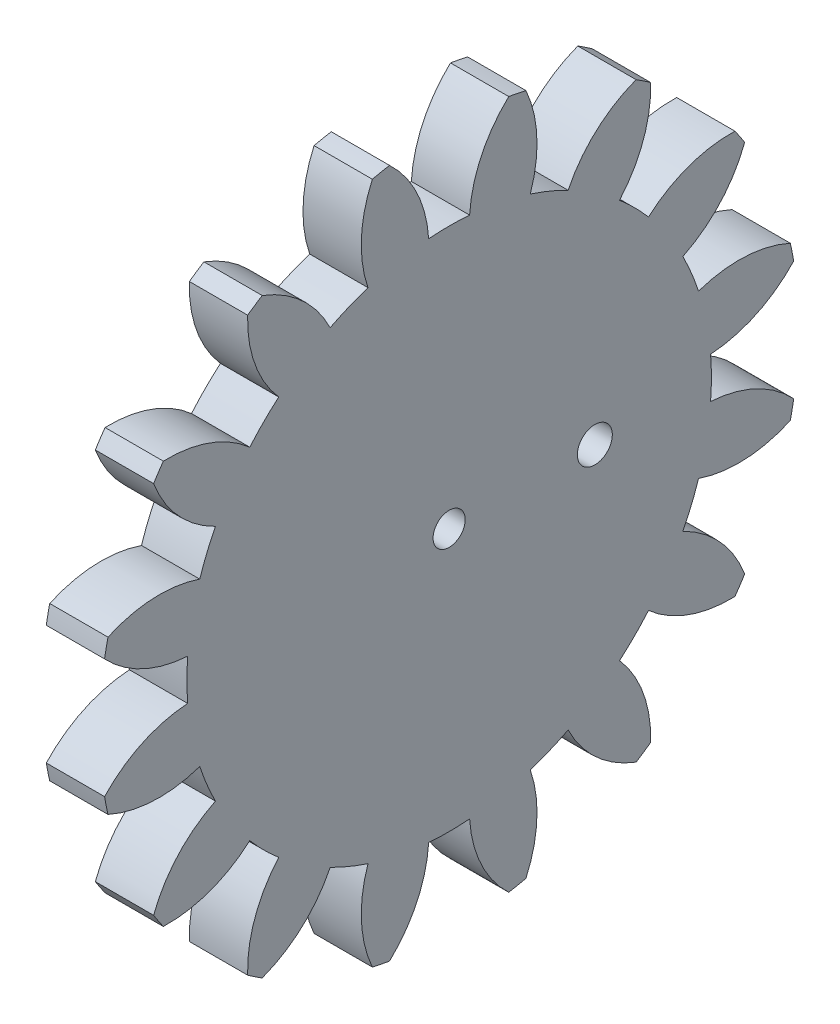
SolidWorks part; units mm, degrees
ref_plane "Plane1" through (0, 0, 0) normal (0, 0, 1) x (1, 0, 0)
ref_plane "Plane2" through (0, 0, 0) normal (0, 1, 0) x (1, 0, 0)
ref_plane "Plane3" through (0, 0, 0) normal (1, 0, 0) x (0, 0, -1)
sketch "HoldingSke" plane through (0, 0, 0) normal (0, 1, 0) x (1, 0, 0)
  line L0 (0, 0) -> (146.4963, -42.0071)
  line L1 (-15, 0) -> (100, 0) construction
  line L2 (0, 0) -> (-2.1039, 2.3779)
  line L3 (0, 0) -> (-11.863, 4.5341)
  line L4 (0, 0) -> (8.3015, 2.3804)
  line L5 (0, 0) -> (-47.5972, -17.7524)
  line L6 (0, 0) -> (-5.2639, -3.5516)
  line L7 (-2.1039, 2.3779) -> (8.8308, 51.9871)
  line L8 (-76.2, 54.61) -> (-69.596, 54.61)
  line L9 (-71.009, 38.7566) -> (-53.1078, 45.2721)
  line L10 (-76.2, 71.12) -> (104.1128, 71.12)
  line L11 (0, 0) -> (-6.35, 0)
  line L12 (-76.2, 101.6) -> (-76.0298, 101.6)
  line L13 (24.9733, 27.94) -> (52.9518, 28.4284)
  line L14 (24.9733, 27.94) -> (24.9746, 27.94)
  line L15 (24.9733, 27.94) -> (100.4006, 29.5858)
  circle A0 centre (0, 0) radius 3.175
  circle A1 centre (0, 0) radius 28.5737
  circle A2 centre (0, 0) radius 38.1
  circle A3 centre (0, 0) radius 3.175
  dimension "MHD" = 57.1475
  dimension "Hub_dia" = 76.2
  dimension "Bore" = 6.35
  dimension "MBD" = 6.35
  dimension "Num_teeth" = 16
  dimension "Pitch_radius" = 180.3128
  dimension "Pitch" = 152.4
  dimension "Width" = 6.35
  dimension "Overall_len" = 50.8
  dimension "Show_teeth" = 16
  dimension "Thickness" = 6.35
  dimension "OAL" = 50.8001
  dimension "T_dim" = 6.604
  dimension "Ap" = 20
  dimension "H" = 19.05
  dimension "Backlash" = 0.1702
  dimension "Addendum_fac" = 1
  dimension "Dedendum_fac" = 1.25
  dimension "Clearance_fac" = 0.25
  dimension "Dedendum_add" = 0.0013
sketch "BasProSke" plane through (0, 0, 0) normal (0, 1, 0) x (1, 0, 0)
  line L0 (-10, 0) -> (60, 0) construction
  line L1 (0, 0) -> (0, 38.1)
  line L2 (0, 0) -> (6.35, 0)
  line L3 (6.35, 0) -> (6.35, 38.1)
  line L4 (6.35, 38.1) -> (0, 38.1)
  dimension "Diameter" = 76.2
  dimension "Thickness" = 6.35
revolve "Base-Revolve" add sketch "BasProSke" angle 360 about L0
sketch "TooCutSke" plane through (0, 0, 0) normal (1, 0, 0) x (0, 0, -1)
  line L1 (0, 0) -> (0, 107) construction
  line L2 (0, 0) -> (-3.6171, 33.673) construction
  line L3 (0, 0) -> (-13.1614, 66.1669) construction
  line L4 (-3.6171, 33.673) -> (-6.5807, 33.0835) construction
  arc A0 (2.2313, 28.4865) -> (-2.2313, 28.4865) centre (0, 0) ccw
  arc A1 (6.5182, 37.5641) -> (-6.5182, 37.5641) centre (0, 0) ccw
  circle A2 centre (0, 0) radius 33.8667 construction
  circle A3 centre (0, 0) radius 31.8243 construction
  arc A4 (-2.2313, 28.4865) -> (-6.5182, 37.5641) centre (-15.7523, 27.6523) ccw
  arc A5 (6.5182, 37.5641) -> (2.2313, 28.4865) centre (15.7523, 27.6523) ccw
  dimension "Root_dia" = 57.1475
  dimension "Overcut_dia" = 76.2508
  dimension "Pitch_dia" = 67.7333
  dimension "Base_dia" = 63.6485
  dimension "Flank_rad" = 13.5467
  dimension "Half_ang" = 11.25
  dimension "Half_CT" = 3.0217
extrude "ToothCut" cut sketch "TooCutSke" along normal through all
fillet "Breaks" [suppressed] radius 0.0847
fillet "RootFillets" [suppressed] radius 1.0596
pattern_circular "TeethCuts" count 16 every 22.5 about axis through (-10, 0, 0) along (1, 0, 0) of "ToothCut", "RootFillets", "Breaks"
sketch "HubNeaOneSke" plane through (0, 0, 0) normal (-1, 0, 0) x (0, 0, 1)
  circle A0 centre (0, 0) radius 28.5737
  dimension "Diameter" = 57.1475
extrude "HubNearOne" [suppressed] add sketch "HubNeaOneSke" along normal blind 44.4501
sketch "HubNeaBotSke" plane through (0, 0, 0) normal (-1, 0, 0) x (0, 0, 1)
  circle A0 centre (0, 0) radius 28.5737
  dimension "Diameter" = 57.1475
extrude "HubNearBoth" [suppressed] add sketch "HubNeaBotSke" along normal blind 22.225
ref_plane "FarPln" through (6.35, 0, 0) normal (1, 0, 0) x (0, 0, -1)
sketch "HubFarSke" plane through (6.35, 0, 0) normal (1, 0, 0) x (0, 0, -1)
  circle A0 centre (0, 0) radius 28.5737
  dimension "Diameter" = 57.1475
extrude "HubFar" [suppressed] add sketch "HubFarSke" along normal blind 22.225
sketch "BorSke" plane through (0, 0, 0) normal (1, 0, 0) x (0, 0, -1)
  circle A0 centre (0, 0) radius 3.175
  dimension "Diameter" = 6.35
extrude "Bore" cut sketch "BorSke" along normal mid plane 101.6001
sketch "KeySke" plane through (0, 0, 0) normal (1, 0, 0) x (0, 0, -1)
  line L0 (-0.127, 0) -> (-0.127, 3.429)
  line L1 (-0.127, 3.429) -> (0.127, 3.429)
  line L2 (0.127, 3.429) -> (0.127, 0)
  line L3 (0, 0) -> (0, 34) construction
  line L4 (-0.127, 0) -> (0.127, 0)
  dimension "Offset" = 3.429
  dimension "Width" = 0.254
extrude "Keyway" [suppressed] cut sketch "KeySke" along normal mid plane 101.6001
pattern_circular "Keyway2" [suppressed] count 2 every 90 about axis through (-10, 0, 0) along (1, 0, 0)
sketch "Sketch1" plane through (6.35, 0, 0) normal (1, 0, 0) x (0, 0, -1)
  circle A0 centre (0, 0) radius 3.175
  circle A1 centre (0, 0) radius 3.175 construction
  circle A2 centre (0, 0) radius 1.75
  dimension "D1" = 3.5
extrude "Boss-Extrude1" add sketch "Sketch1" against normal up to surface (6.35 mm away)
sketch "Sketch2" plane through (6.35, 0, 0) normal (1, 0, 0) x (0, 0, -1)
  circle A0 centre (15.875, 0) radius 1.905
  dimension "D1" = 3.81
  dimension "D2" = 15.875
extrude "Cut-Extrude1" cut sketch "Sketch2" against normal up to next
equation "' \"Pitch@HoldingSke\" = 4"
equation "' \"Num_teeth@HoldingSke\" = 12"
equation "' \"Ap@HoldingSke\" =  20"
equation "' \"Width@HoldingSke\" = 0.5"
equation "' \"Hub_dia@HoldingSke\"= 1"
equation "' \"Overall_len@HoldingSke\" = 1.0"
equation "' \"Bore@HoldingSke\" = 0.75"
equation "' \"T_dim@HoldingSke\" = 0.85"
equation "' \"Width@KeySke\" = 0.25"
equation "' \"Show_teeth@HoldingSke\" = 13"
equation "' \"Backlash@HoldingSke\" = 0.009"
equation "' \"Addendum_fac@HoldingSke\" = 1.0"
equation "' \"Dedendum_fac@HoldingSke\" = 1.25"
equation "' \"Dedendum_add@HoldingSke\" = 0.00005"
equation "' \"Clearance_fac@HoldingSke\" = 0.25"
equation "' \"Pitch@HoldingSke\" = 0.5"
equation "' \"Num_teeth@HoldingSke\" = 23"
equation "' \"Show_teeth@HoldingSke\" = 23"
equation "' \"Backlash@HoldingSke\" = 0.0375"
equation "\"Overcut_dia@TooCutSke\" = (\"Num_teeth@HoldingSke\" + 2 * \"Addendum_fac@HoldingSke\") / \"Pitch@HoldingSke\" + 0.002"
equation "\"Pitch_dia@TooCutSke\" = \"Num_teeth@HoldingSke\" / \"Pitch@HoldingSke\""
equation "\"Base_dia@TooCutSke\" = \"Num_teeth@HoldingSke\" / \"Pitch@HoldingSke\" * cos((\"Ap@HoldingSke\"  * 3.14159265 / 180))"
equation "\"Root_dia@TooCutSke\" = (\"Num_teeth@HoldingSke\" + 2) / \"Pitch@HoldingSke\" - 2 * (\"Addendum_fac@HoldingSke\" + \"Dedendum_fac@HoldingSke\") / \"Pitch@HoldingSke\" - \"Dedendum_add@HoldingSke\" * 2"
equation "\"Half_ang@TooCutSke\" = 180 / \"Num_teeth@HoldingSke\""
equation "\"Half_CT@TooCutSke\" = \"Num_teeth@HoldingSke\" / \"Pitch@HoldingSke\" * sin((3.14159265 / 2 / \"Num_teeth@HoldingSke\")) / 2 - 7 * \"Backlash@HoldingSke\" / 4"
equation "\"Flank_rad@TooCutSke\" = \"Num_teeth@HoldingSke\" / \"Pitch@HoldingSke\" / 5"
equation "\"Radius@RootFillets\" = \"Clearance_fac@HoldingSke\" / \"Pitch@HoldingSke\" + \"Dedendum_add@HoldingSke\""
equation "\"Break_rad@Breaks\" = 0.02 / \"Pitch@HoldingSke\""
equation "\"Thickness@HoldingSke\" = \"Width@HoldingSke\""
equation "\"OAL@HoldingSke\" = \"Thickness@HoldingSke\""
equation "\"MHD@HoldingSke\" = (\"Num_teeth@HoldingSke\" + 2) / \"Pitch@HoldingSke\" - 2 * (\"Addendum_fac@HoldingSke\" + \"Dedendum_fac@HoldingSke\")  / \"Pitch@HoldingSke\" - \"Dedendum_add@HoldingSke\" * 2"
equation "\"MBD@HoldingSke\" = (\"Num_teeth@HoldingSke\" + 2) / \"Pitch@HoldingSke\" - 2 * (\"Addendum_fac@HoldingSke\" + \"Dedendum_fac@HoldingSke\")  / \"Pitch@HoldingSke\" - \"Dedendum_add@HoldingSke\" * 2 - 0.002"
equation "\"MHD@HoldingSke\" = ((sgn( \"MHD@HoldingSke\" - \"Hub_dia@HoldingSke\" )-1)*( \"MHD@HoldingSke\" - \"Hub_dia@HoldingSke\" ))/-2+ \"Hub_dia@HoldingSke\""
equation "\"MBD@HoldingSke\" = ((sgn( \"MBD@HoldingSke\" - \"Bore@HoldingSke\" )-1)*( \"MBD@HoldingSke\" - \"Bore@HoldingSke\" ))/-2+ \"Bore@HoldingSke\""
equation "\"OAL@HoldingSke\" = ((sgn( \"OAL@HoldingSke\" - \"Overall_len@HoldingSke\" )+1)*( \"OAL@HoldingSke\" - \"Overall_len@HoldingSke\" ))/2 + \"Overall_len@HoldingSke\" + 0.000002"
equation "\"Num_teeth@TeethCuts\" = int( \"Show_teeth@HoldingSke\" ) + 1"
equation "\"Num_teeth@TeethCuts\" = ((sgn( \"Num_teeth@TeethCuts\" - \"Num_teeth@HoldingSke\" )-1)*( \"Num_teeth@TeethCuts\" - \"Num_teeth@HoldingSke\" ))/-2+ \"Num_teeth@HoldingSke\""
equation "\"Num_teeth@TeethCuts\" = ((sgn( \"Num_teeth@TeethCuts\" - 2.0)+1)*( \"Num_teeth@TeethCuts\" - 2.0))/2 +2.0"
equation "\"Angle@TeethCuts\" = 360.0 / \"Num_teeth@HoldingSke\""
equation "\"Diameter@BasProSke\" = (\"Num_teeth@HoldingSke\" + 2 * \"Addendum_fac@HoldingSke\") / \"Pitch@HoldingSke\""
equation "\"Thickness@BasProSke\"  = \"Thickness@HoldingSke\""
equation "' \"Fillet_rad@BasProSke\" =  \"Thickness@HoldingSke\" * 0.05"
equation "\"MHD@HoldingSke\" = ((sgn( \"MHD@HoldingSke\" - \"Root_dia@TooCutSke\" )-1)*( \"MHD@HoldingSke\" - \"Root_dia@TooCutSke\" ))/-2+ \"Root_dia@TooCutSke\""
equation "\"Diameter@HubNeaOneSke\" = \"MHD@HoldingSke\""
equation "\"Length@HubNearOne\" = \"OAL@HoldingSke\" - \"Thickness@BasProSke\""
equation "\"Diameter@HubNeaBotSke\" = \"MHD@HoldingSke\""
equation "\"Length@HubNearBoth\" = ( \"OAL@HoldingSke\" - \"Thickness@BasProSke\" ) / 2.0"
equation "\"Thickness@FarPln\" = \"Thickness@BasProSke\""
equation "\"Diameter@HubFarSke\" = \"MHD@HoldingSke\""
equation "\"Length@HubFar\" = ( \"OAL@HoldingSke\" - \"Thickness@BasProSke\" ) / 2.0"
equation "\"Diameter@BorSke\" = \"MBD@HoldingSke\""
equation "\"D1@Bore\" = \"OAL@HoldingSke\" * 2.0"
equation "\"D1@Keyway\" = \"OAL@HoldingSke\" * 2.0"
equation "\"Offset@KeySke\" = \"T_dim@HoldingSke\" - \"MBD@HoldingSke\" / 2.0"
